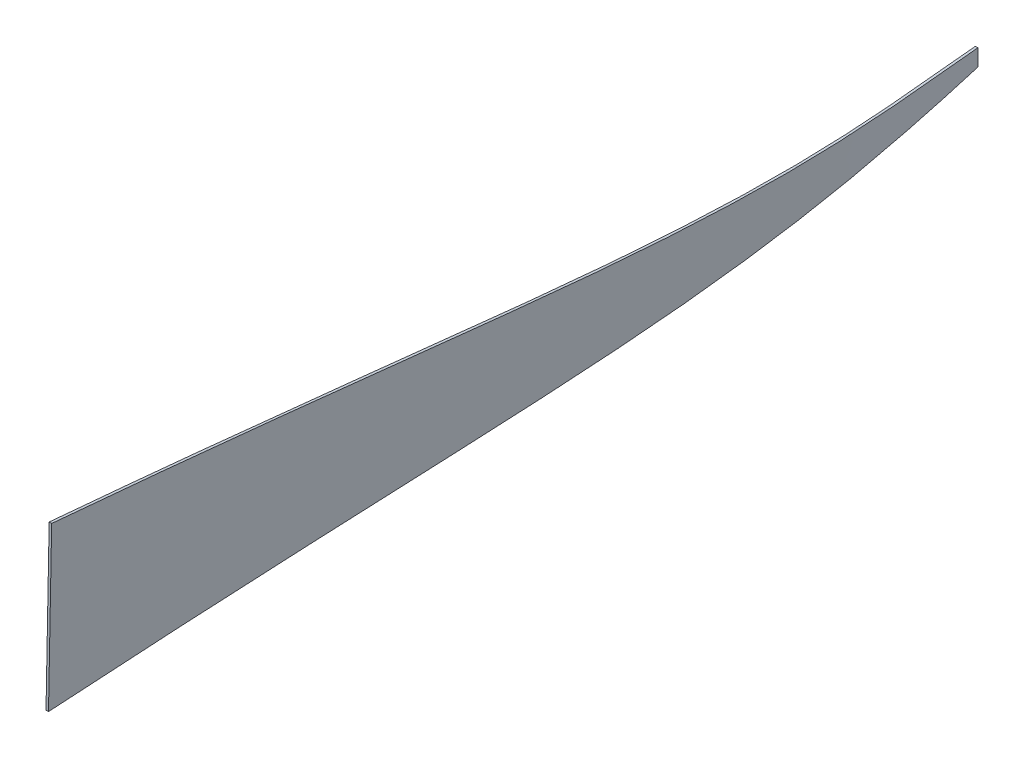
SolidWorks part; units mm, degrees
ref_plane "Ebene vorne" through (0, 0, 0) normal (0, 0, 1) x (1, 0, 0)
ref_plane "Ebene oben" through (0, 0, 0) normal (0, 1, 0) x (1, 0, 0)
ref_plane "Ebene rechts" through (0, 0, 0) normal (1, 0, 0) x (0, 0, -1)
imported_body "Basisteil-Wand"
curve "ZusammengKurve1"
curve "ZusammengKurve2"
sketch3d "3D-Skizze1"
  point P0 (83.5407, 37.0656, -221.4444)
  point P1 (83.54, 45.7819, -132.701)
  point P2 (75.9975, 23.181, -412.9508)
  dimension "D1" = 0
sketch3d "3D-Skizze2"
  point P0 (83.54, -1.7423, -131.7695)
  point P1 (75.9975, 18.2593, -412.9508)
  dimension "D1" = 0
sheet metal parameters "Blech1" thickness 0.7366 parameters "D1"=4, "Dicke"=0.7366
lofted bend "Ausgeformte Biegungen1" parameters "D1"=0, "D12"=0.7366
other "Freiform-Biegung1" parameters "D1"=1000, "D4"=57.296, "D5"=1
flat pattern "Abwicklung1"
sketch "Biegung-Linien1" plane through (0, 0, 0) normal (0, 1, 0) x (-1, 0, 0)
other "Abwickeln-<Freiform-Biegung1>1"
